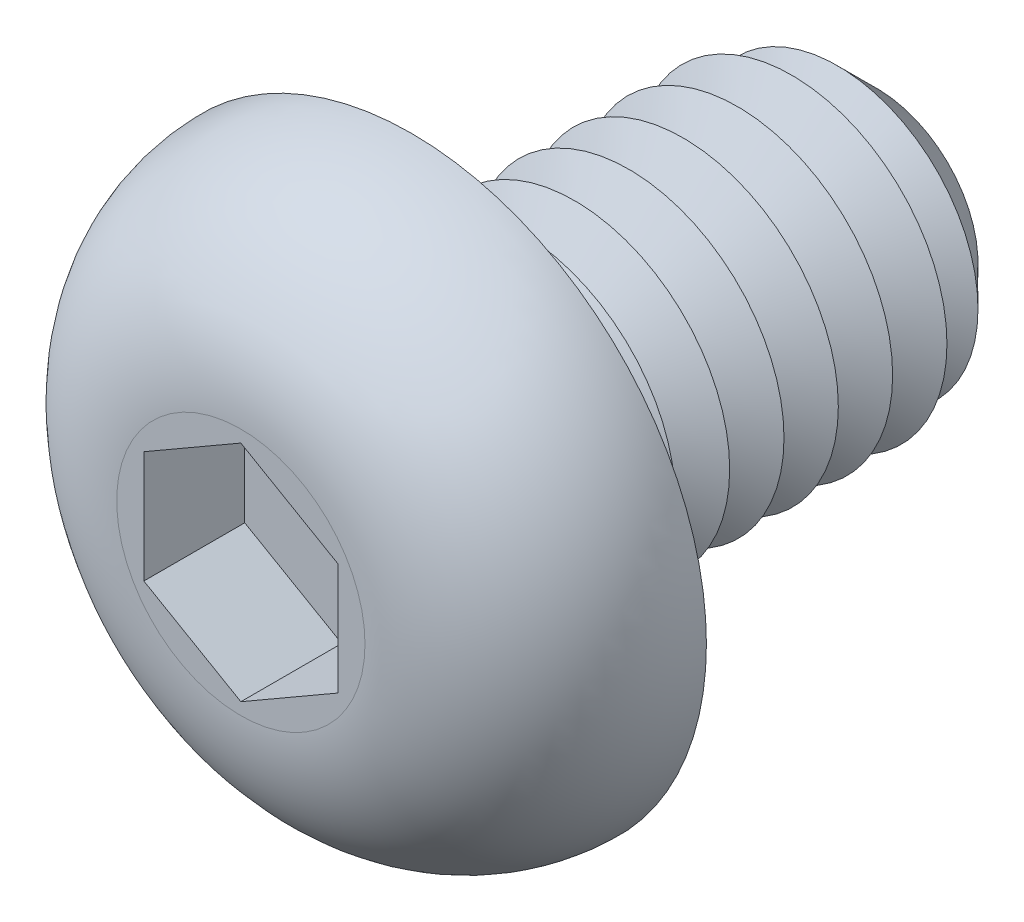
SolidWorks part; units mm, degrees
ref_plane "Front Plane" through (0, 0, 0) normal (0, 0, 1) x (1, 0, 0)
ref_plane "Top Plane" through (0, 0, 0) normal (0, 1, 0) x (1, 0, 0)
ref_plane "Right Plane" through (0, 0, 0) normal (1, 0, 0) x (0, 0, -1)
sketch "Sketch1" plane through (0, 0, 0) normal (1, 0, 0) x (0, 0, -1)
  line L0 (-47.9342, 0) -> (60.3146, 0) construction
sketch "Sketch2" plane through (0, 0, 0) normal (1, 0, 0) x (0, 0, -1)
  line L0 (0, 0) -> (-2.2, 0)
  line L1 (-47.9342, 0) -> (60.3146, 0) construction
  line L2 (-2.2, 0) -> (-2.2, 1.6)
  line L3 (0, 3.8) -> (0, 0)
  arc A0 (-2.2, 1.6) -> (0, 3.8) centre (0, 1.6) cw
  dimension "D1" = 2.2
  dimension "D2" = 2.2
  dimension "D3" = 3.8
revolve "Revolve1" add sketch "Sketch2" angle 360 about L0
sketch "Sketch3" plane through (0, 0, 2.2) normal (0, 0, 1) x (1, 0, 0)
  line L1 (0, 1.4434) -> (-1.25, 0.7217)
  line L2 (-1.25, 0.7217) -> (-1.25, -0.7217)
  line L3 (-1.25, -0.7217) -> (0, -1.4434)
  line L4 (0, -1.4434) -> (1.25, -0.7217)
  line L5 (1.25, -0.7217) -> (1.25, 0.7217)
  line L6 (1.25, 0.7217) -> (0, 1.4434)
  circle A0 centre (0, 0) radius 1.25 construction
  dimension "D1" = 2.5
extrude "Cut-Extrude1" cut sketch "Sketch3" against normal blind 1.3
sketch "Sketch4" plane through (0, 0, 0) normal (0, 0, -1) x (-1, 0, 0)
  circle A0 centre (0, 0) radius 2
  dimension "D1" = 4
extrude "Boss-Extrude1" add sketch "Sketch4" along normal blind 6
chamfer "Chamfer1" distance 0.7 angle 45 1 edges at (-2, 0, -6)
sketch "Sketch5" plane through (0, 0, 0) normal (1, 0, 0) x (0, 0, -1)
  line L0 (0.7, 2) -> (1.4, 2)
  line L1 (5.3, 2) -> (0, 2) construction
  line L2 (1.4, 2) -> (1.05, 1.3938)
  line L3 (1.05, 1.3938) -> (0.7, 2)
  line L4 (0, -3.8) -> (0, 3.8) construction
  line L5 (5.3, 2) -> (0, 2) construction
  dimension "D1" = 0.7
  dimension "D2" = 0.7
revolve "Cut-Revolve1" cut sketch "Sketch5" angle 360 about L0
pattern_linear "LPattern1" count 7 spacing 0.7 along (0, 0, -1) of "Cut-Revolve1"
fillet "Fillet2" radius 0.35 1 edges at (2, 0, 0)
sketch "Sketch6" plane through (0, 0, 0.9) normal (0, 0, 1) x (1, 0, 0)
  circle A0 centre (0, 0) radius 0.5
  dimension "D1" = 1
extrude "Cut-Extrude2" cut sketch "Sketch6" against normal up to surface (6.9 mm away)
